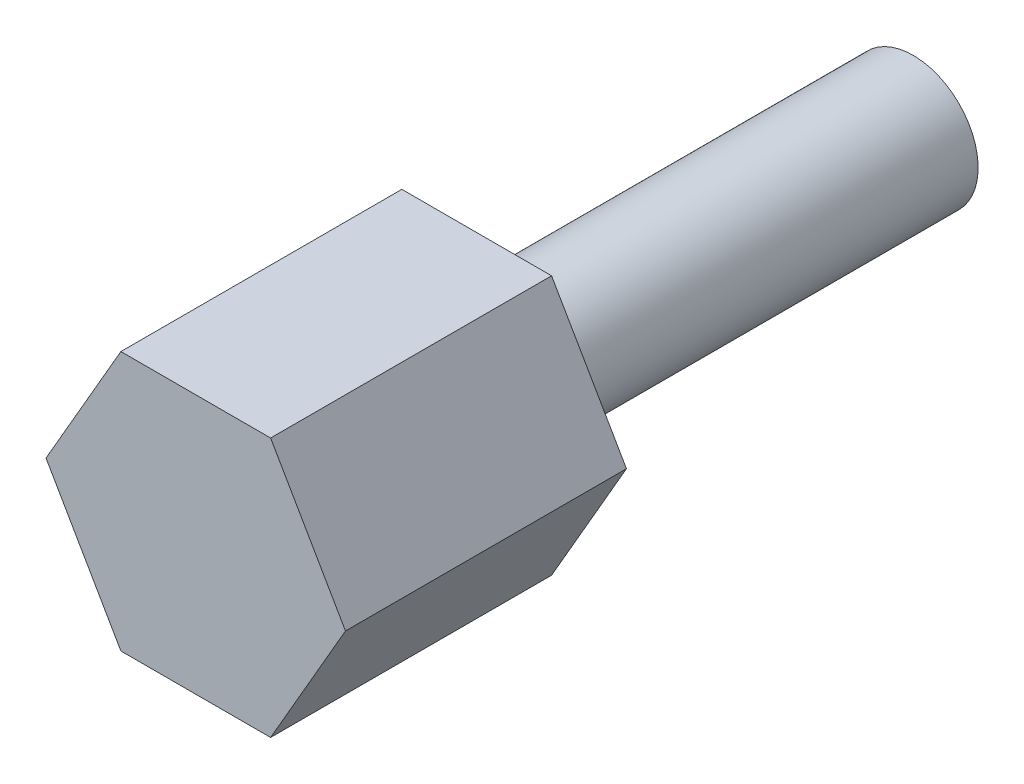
SolidWorks part; units mm, degrees
ref_plane "Front" through (0, 0, 0) normal (0, 0, 1) x (1, 0, 0)
ref_plane "Top" through (0, 0, 0) normal (0, 1, 0) x (1, 0, 0)
ref_plane "Right" through (0, 0, 0) normal (1, 0, 0) x (0, 0, -1)
sketch "Sketch1" plane through (0, 0, 0) normal (0, 0, 1) x (1, 0, 0)
  line L1 (1.7321, -3) -> (3.4641, 0)
  line L2 (3.4641, 0) -> (1.7321, 3)
  line L3 (1.7321, 3) -> (-1.7321, 3)
  line L4 (-1.7321, 3) -> (-3.4641, 0)
  line L5 (-3.4641, 0) -> (-1.7321, -3)
  line L6 (-1.7321, -3) -> (1.7321, -3)
  circle A0 centre (0, 0) radius 3 construction
  dimension "D1" = 6
  dimension "D2" = 6.9282
extrude "Extrude1" add sketch "Sketch1" along normal blind 6.5
sketch "Sketch2" plane through (0, 0, 0) normal (0, 0, -1) x (-1, 0, 0)
  circle A0 centre (0, 0) radius 1.5
  dimension "D1" = 3
extrude "Extrude2" add sketch "Sketch2" along normal blind 10.1
